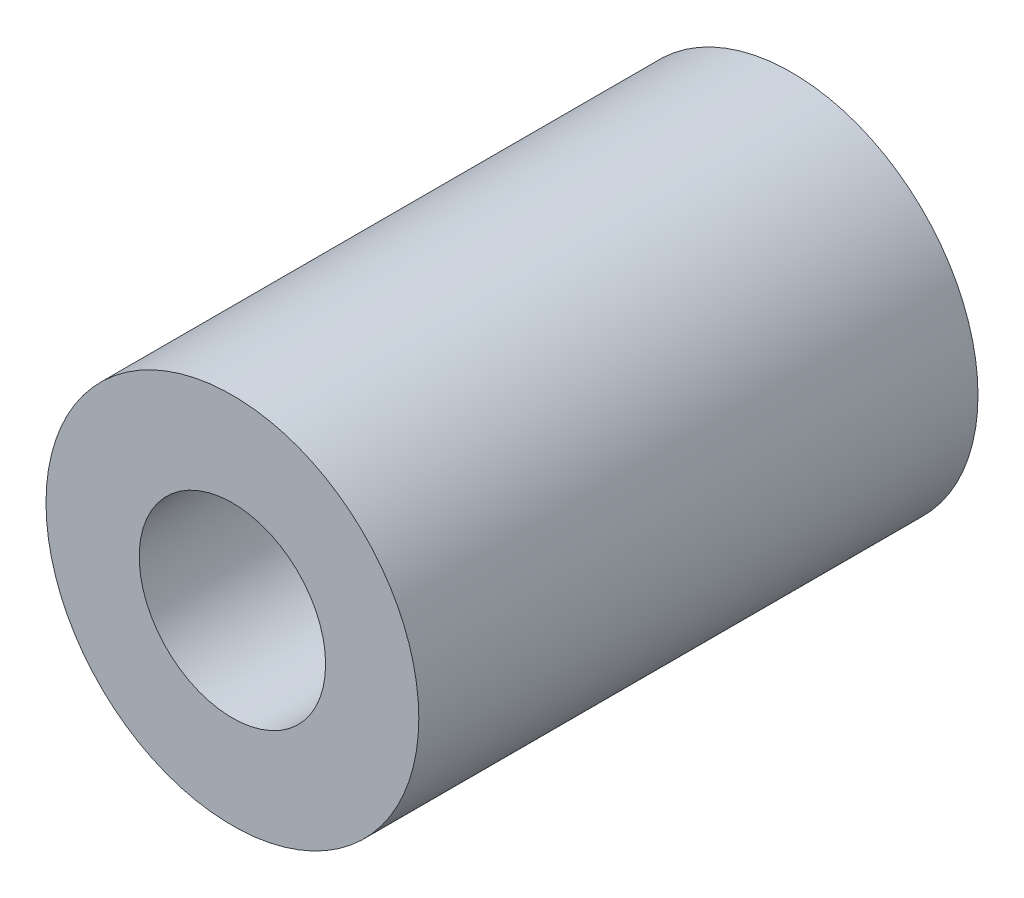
SolidWorks part; units mm, degrees
ref_plane "Front Plane" through (0, 0, 0) normal (0, 0, 1) x (1, 0, 0)
ref_plane "Top Plane" through (0, 0, 0) normal (0, 1, 0) x (1, 0, 0)
ref_plane "Right Plane" through (0, 0, 0) normal (1, 0, 0) x (0, 0, -1)
sketch "Sketch1" plane through (0, 0, 0) normal (0, 0, 1) x (1, 0, 0)
  circle A0 centre (0, 0) radius 10
  dimension "D1" = 20
extrude "Extrude1" add sketch "Sketch1" along normal blind 30
sketch "Sketch2" plane through (0, 0, 30) normal (0, 0, 1) x (1, 0, 0)
  circle A0 centre (0, 0) radius 5
  dimension "D1" = 10
extrude "Cut-Extrude1" cut sketch "Sketch2" against normal through all
